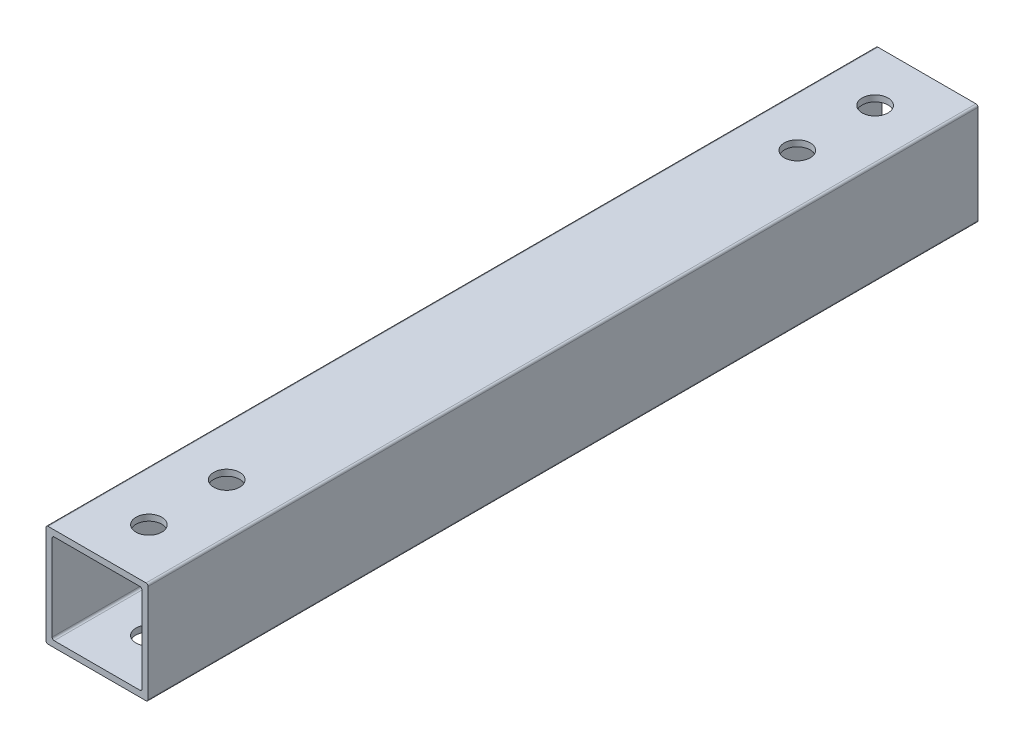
SolidWorks part; units mm, degrees
ref_plane "Front Plane" through (0, 0, 0) normal (0, 0, 1) x (1, 0, 0)
ref_plane "Top Plane" through (0, 0, 0) normal (0, 1, 0) x (1, 0, 0)
ref_plane "Right Plane" through (0, 0, 0) normal (1, 0, 0) x (0, 0, -1)
ref_plane "Plane1" through (0, 0, -2000) normal (0, 0, -1) x (-1, 0, 0)
sketch "Sketch1" plane through (0, 0, -2000) normal (0, 0, -1) x (-1, 0, 0)
  line L0 (11, 10.5) -> (11, -10.5)
  line L1 (10.5, -11) -> (-10.5, -11)
  line L2 (-11, -10.5) -> (-11, 10.5)
  line L3 (-10.5, 11) -> (10.5, 11)
  line L4 (12.5, -12) -> (12.5, 12)
  line L5 (12, 12.5) -> (-12, 12.5)
  line L6 (-12.5, 12) -> (-12.5, -12)
  line L7 (-12, -12.5) -> (12, -12.5)
  line L8 (0, 12.5) -> (0, -12.5) construction
  line L9 (-12.5, 0) -> (12.5, 0) construction
  arc A0 (11, -10.5) -> (10.5, -11) centre (10.5, -10.5) cw
  arc A1 (-10.5, -11) -> (-11, -10.5) centre (-10.5, -10.5) cw
  arc A2 (-11, 10.5) -> (-10.5, 11) centre (-10.5, 10.5) cw
  arc A3 (10.5, 11) -> (11, 10.5) centre (10.5, 10.5) cw
  arc A4 (12.5, 12) -> (12, 12.5) centre (12, 12) ccw
  arc A5 (-12, 12.5) -> (-12.5, 12) centre (-12, 12) ccw
  arc A6 (-12.5, -12) -> (-12, -12.5) centre (-12, -12) ccw
  arc A7 (12, -12.5) -> (12.5, -12) centre (12, -12) ccw
  dimension "D7" = 0.5
  dimension "D8" = 0.5
  dimension "D9" = 0.5
  dimension "D10" = 0.5
  dimension "D11" = 0.5
  dimension "D1" = 25
  dimension "D2" = 25
  dimension "D3" = 1.5
  dimension "D4" = 1.5
  dimension "D5" = 1.5
  dimension "D6" = 1.5
extrude "Boss-Extrude1" add sketch "Sketch1" against normal blind 203.2
sketch "Sketch2" plane through (0, 12.5, 0) normal (0, 1, 0) x (1, 0, 0)
  line L0 (-12, 1898.4) -> (12, 1898.4) construction
  line L1 (-12, 1796.8) -> (-12, 2000) construction
  line L2 (12, 1796.8) -> (12, 2000) construction
  line L3 (0, 2000) -> (0, 1796.8) construction
  line L4 (-12, 2000) -> (12, 2000) construction
  line L5 (-12, 1796.8) -> (12, 1796.8) construction
  circle A0 centre (0, 1987.3) radius 3.175
  circle A1 centre (0, 1968.25) radius 3.175
  circle A2 centre (0, 1828.55) radius 3.175
  circle A3 centre (0, 1809.5) radius 3.175
  dimension "D3" = 6.35
  dimension "D4" = 6.35
  dimension "D1" = 12.7
  dimension "D2" = 31.75
extrude "Cut-Extrude1" cut sketch "Sketch2" against normal up to surface (25 mm away)
